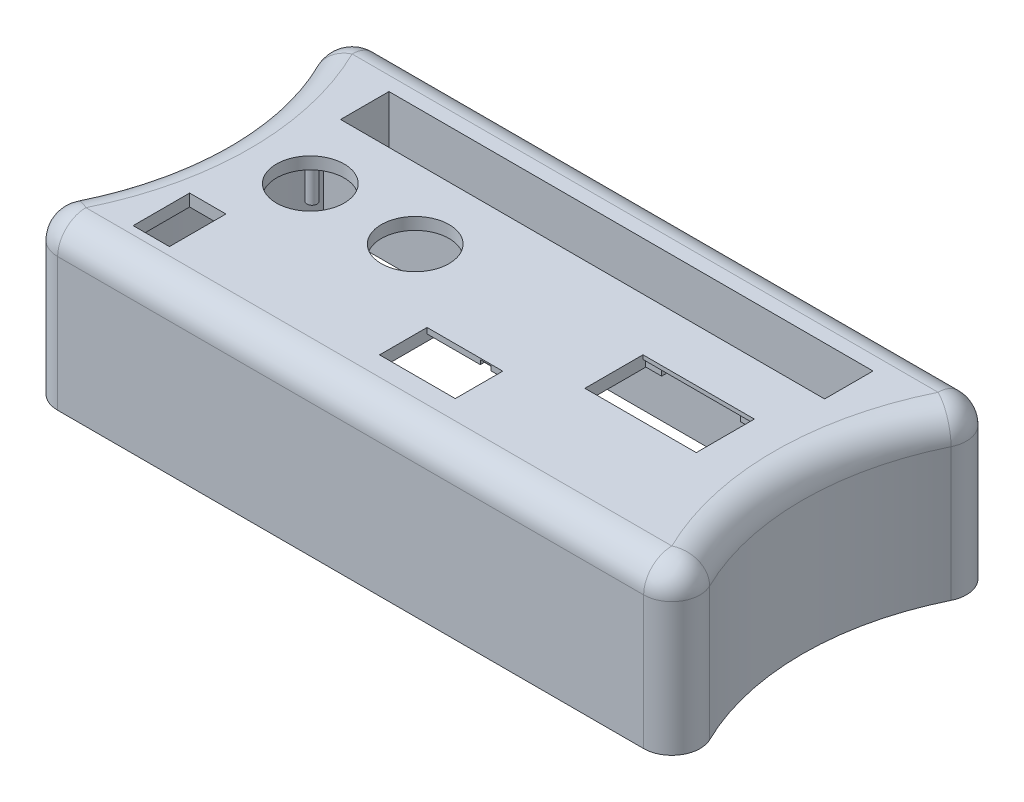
SolidWorks part; units mm, degrees
ref_plane "Alzado" through (0, 0, 0) normal (0, 0, 1) x (1, 0, 0)
ref_plane "Planta" through (0, 0, 0) normal (0, 1, 0) x (1, 0, 0)
ref_plane "Vista lateral" through (0, 0, 0) normal (1, 0, 0) x (0, 0, -1)
sketch "Croquis1" plane through (0, 0, 0) normal (0, 1, 0) x (1, 0, 0)
  line L4 (-85, -40) -> (85, -40)
  line L6 (-85, 40) -> (85, 40)
  line L8 (-85, -40) -> (85, 40) construction
  line L9 (-85, 40) -> (85, -40) construction
  arc A4 (-85, 40) -> (-85, -40) centre (-139.9199, 0) cw
  arc A5 (85, 40) -> (85, -40) centre (139.9199, 0) ccw
  point P0 (0, 0)
  dimension "D1" = 170
  dimension "D3" = 67.9426
  dimension "D2" = 80
extrude "Saliente-Extruir1" add sketch "Croquis1" along normal blind 40
fillet "Redondeo8" radius 7 4 edges at (71.9773, 40, 0) (0, 40, 40) (-71.9773, 40, 0) (0, 40, -40)
fillet "Redondeo9" radius 7 8 edges at (84.1714, 35.4013, -39.5752) (84.1714, 35.4013, 39.5752) (-84.1714, 35.4013, 39.5752) (-84.1714, 35.4013, -39.5752) (85, 16.5, -40) (85, 16.5, 40) (-85, 16.5, 40) (-85, 16.5, -40)
sketch "Croquis3" plane through (0, 40, 0) normal (0, 1, 0) x (1, 0, 0)
  line L0 (72.634, -40) -> (-72.634, -40) construction
  line L1 (-60, 29.5002) -> (60, 29.5002)
  line L2 (-60, 29.5002) -> (-60, 17.5002)
  line L3 (-60, 17.5002) -> (60, 17.5002)
  line L4 (60, 29.5002) -> (60, 17.5002)
  line L5 (28, 4.4692) -> (55.61, 4.4692)
  line L6 (28, 4.4692) -> (28, -9.9308)
  line L7 (28, -9.9308) -> (55.61, -9.9308)
  line L8 (55.61, 4.4692) -> (55.61, -9.9308)
  line L9 (-4.634, -13.82) -> (14.136, -13.82)
  line L10 (-4.634, -13.82) -> (-4.634, -28.2)
  line L11 (-4.634, -28.2) -> (14.136, -28.2)
  line L12 (14.136, -13.82) -> (14.136, -28.2)
  line L13 (-72.634, 40) -> (72.634, 40) construction
  line L15 (72.634, 33) -> (72.634, 40) construction
  circle A1 centre (-50, 0) radius 8.4
  circle A2 centre (-24, 0) radius 8.4
  arc A3 (-78.9188, -29.9176) -> (-72.634, -40) centre (-72.634, -33) ccw construction
  point P26 (28, -2.7308)
  dimension "D5" = 16.8
  dimension "D6" = 26
  dimension "D7" = 16.8
  dimension "D1" = 120
  dimension "D2" = 12
  dimension "D3" = 27.61
  dimension "D4" = 14.4
  dimension "D8" = 18.77
  dimension "D9" = 14.38
  dimension "D10" = 11.8
  dimension "D11" = 68
  dimension "D12" = 24
  dimension "D13" = 28
  dimension "D14" = 13.031
  dimension "D15" = 10.4998
  dimension "D16" = 12.634
shell "Vaciado1" thickness 3
extrude "Cortar-Extruir2" cut sketch "Croquis3" against normal through all
sketch "Croquis5" plane through (0, 37, 0) normal (0, -1, 0) x (1, 0, 0)
  circle A0 centre (-15.9726, 8.5003) radius 1.2633 construction
  circle A1 centre (-15.9726, 8.5003) radius 1.2633
  circle A2 centre (-16.016, -8.4959) radius 1.2633 construction
  circle A3 centre (-16.016, -8.4959) radius 1.2633
  circle A4 centre (-58.0095, -8.4357) radius 1.2633 construction
  circle A5 centre (-58.0095, -8.4357) radius 1.2633
  circle A6 centre (-57.98, 8.5792) radius 1.2633 construction
  circle A7 centre (-57.98, 8.5792) radius 1.2633
extrude "Saliente-Extruir2" add sketch "Croquis5" along normal up to vertex
sketch "Sketch1" plane through (0, 37, 0) normal (0, -1, 0) x (1, 0, 0)
  line L0 (28.155, -9.0892) -> (55.455, -9.0892) construction
  line L1 (28, -9.0892) -> (55.61, -9.0892)
  line L2 (48.805, 18.7108) -> (55.455, 18.7108) construction
  line L3 (28, 18.7108) -> (55.61, 18.7108)
  line L4 (28, -4.4692) -> (28, 9.9308) construction
  line L5 (28, -9.0892) -> (28, 18.7108)
  line L6 (55.61, 9.9308) -> (55.61, -4.4692) construction
  line L7 (55.61, 18.7108) -> (55.61, -9.0892)
extrude "Cut-Extrude1" cut sketch "Sketch1" against normal blind 2
sketch "Sketch2" plane through (0, 39, 0) normal (0, -1, 0) x (1, 0, 0)
  line L0 (55.61, -9.0892) -> (55.61, -4.4692) construction
  line L1 (28, -9.0892) -> (32, -9.0892)
  line L2 (28, -9.0892) -> (28, -5.0892)
  line L3 (28, -5.0892) -> (32, -5.0892)
  line L4 (32, -9.0892) -> (32, -5.0892)
  line L5 (28, 18.7108) -> (32, 18.7108)
  line L6 (28, 18.7108) -> (28, 14.7108)
  line L7 (28, 14.7108) -> (32, 14.7108)
  line L8 (32, 18.7108) -> (32, 14.7108)
  line L9 (55.61, 18.7108) -> (51.61, 18.7108)
  line L10 (55.61, 18.7108) -> (55.61, 14.7108)
  line L11 (55.61, 14.7108) -> (51.61, 14.7108)
  line L12 (51.61, 18.7108) -> (51.61, 14.7108)
  line L13 (55.61, -9.0892) -> (51.61, -9.0892)
  line L14 (55.61, -9.0892) -> (55.61, -5.0892)
  line L15 (55.61, -5.0892) -> (51.61, -5.0892)
  line L16 (51.61, -9.0892) -> (51.61, -5.0892)
  line L17 (55.61, 18.7108) -> (55.61, -9.0892) construction
  line L18 (28, -9.0892) -> (55.61, -9.0892) construction
  dimension "D1" = 4
  dimension "D2" = 4
extrude "Boss-Extrude2" add sketch "Sketch2" along normal up to surface (1.9 mm away)
sketch "Sketch3" plane through (0, 40, 0) normal (0, 1, 0) x (1, 0, 0)
  line L0 (14.136, -28.2) -> (14.136, -13.82) construction
  line L9 (-4.634, -13.82) -> (14.136, -13.82)
  line L10 (-4.634, -13.82) -> (-4.634, -16.42)
  line L11 (-4.634, -16.42) -> (14.136, -16.42)
  line L12 (14.136, -13.82) -> (14.136, -16.42)
  line L17 (14.136, -13.82) -> (-4.634, -13.82) construction
  dimension "D2" = 2.6
extrude "Boss-Extrude3" add sketch "Sketch3" against normal up to surface (1.4 mm away)
sketch "Sketch4" plane through (0, 0, 16.42) normal (0, 0, 1) x (1, 0, 0)
  line L0 (-4.634, 38.6) -> (14.136, 38.6) construction
  line L1 (11.266, 38.6) -> (8.566, 38.6)
  line L2 (11.266, 38.6) -> (11.266, 39.7)
  line L3 (11.266, 39.7) -> (8.566, 39.7)
  line L4 (8.566, 38.6) -> (8.566, 39.7)
  line L5 (14.136, 38.6) -> (14.136, 40) construction
  dimension "D1" = 2.87
  dimension "D2" = 2.7
  dimension "D3" = 1.1
extrude "Cut-Extrude2" cut sketch "Sketch4" against normal up to surface (2.6 mm away)
sketch "Sketch6" plane through (0, 37, 0) normal (0, -1, 0) x (1, 0, 0)
  line L0 (-72.634, -37) -> (72.634, -37) construction
  line L1 (-62.3818, -15.6) -> (62.0381, -15.6)
  line L2 (-62.3818, -15.6) -> (-62.3818, -31.6)
  line L3 (-62.3818, -31.6) -> (62.0381, -31.6)
  line L4 (62.0381, -15.6) -> (62.0381, -31.6)
  arc A0 (-72.634, -33) -> (-72.634, 33) centre (-139.9199, 0) ccw construction
  dimension "D1" = 124.42
  dimension "D2" = 16
  dimension "D3" = 5.4
  dimension "D4" = 77.538
extrude "Boss-Extrude4" add sketch "Sketch6" along normal blind 20
sketch "Sketch11" plane through (62.0381, 0, 0) normal (1, 0, 0) x (0, 0, -1)
  line L1 (30.5887, 33.5445) -> (18.5958, 33.5445)
  line L2 (30.5887, 33.5445) -> (30.5887, 17.7445)
  line L3 (30.5887, 17.7445) -> (18.5958, 17.7445)
  line L4 (18.5958, 33.5445) -> (18.5958, 17.7445)
  dimension "D1" = 15.8
  dimension "D2" = 11.9929
extrude "Cut-Extrude6" cut sketch "Sketch11" against normal blind 5
sketch "Sketch12" plane through (0, 0, -40) normal (0, 0, -1) x (-1, 0, 0)
  line L0 (72.634, 0) -> (72.634, 33) construction
  line L1 (-7.366, 17) -> (5.634, 17)
  line L2 (-7.366, 17) -> (-7.366, 10)
  line L3 (-7.366, 10) -> (5.634, 10)
  line L4 (5.634, 17) -> (5.634, 10)
  line L5 (72.634, 33) -> (-72.634, 33) construction
  dimension "D1" = 13
  dimension "D2" = 7
  dimension "D3" = 67
  dimension "D4" = 16
extrude "Cut-Extrude7" cut sketch "Sketch12" against normal blind 10
sketch "Sketch14" plane through (0, 40, 0) normal (0, 1, 0) x (1, 0, 0)
  line L0 (-72.634, -33) -> (72.634, -33) construction
  line L1 (-62.9199, -17) -> (-53.9199, -17)
  line L2 (-62.9199, -17) -> (-62.9199, -31)
  line L3 (-62.9199, -31) -> (-53.9199, -31)
  line L4 (-53.9199, -17) -> (-53.9199, -31)
  arc A1 (-72.634, -33) -> (-72.634, 33) centre (-139.9199, 0) ccw construction
  dimension "D1" = 14
  dimension "D2" = 9
  dimension "D3" = 2
  dimension "D4" = 77
extrude "Cut-Extrude9" cut sketch "Sketch14" against normal blind 20
sketch "Sketch18" plane through (0, 37, 0) normal (0, 1, 0) x (1, 0, 0)
  line L4 (60, 29.5002) -> (-60, 29.5002)
  line L5 (-60, 29.5002) -> (-60, 17.5002)
  line L6 (-60, 17.5002) -> (60, 17.5002)
  line L7 (60, 17.5002) -> (60, 29.5002)
  line L8 (60, 29.5002) -> (-60, 29.5002)
  line L9 (-60, 29.5002) -> (-60, 17.5002)
  line L10 (-60, 17.5002) -> (60, 17.5002)
  line L11 (60, 17.5002) -> (60, 29.5002)
  dimension "D1" = 0
extrude "Cut-Extrude10" cut sketch "Sketch18" against normal blind 18
